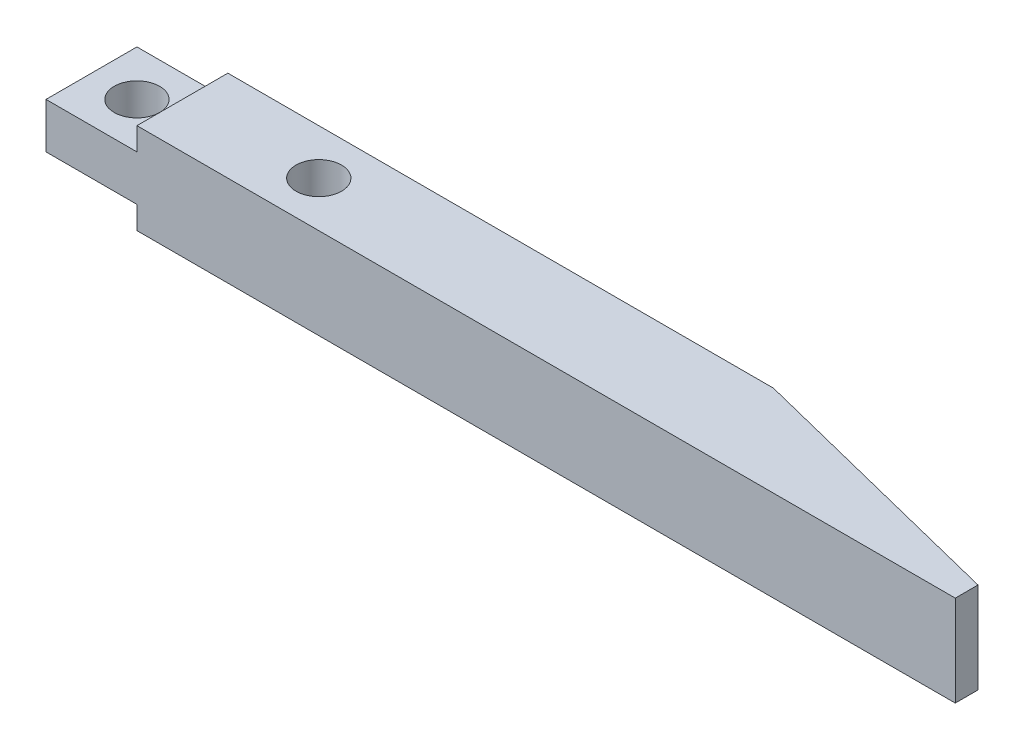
SolidWorks part; units mm, degrees
ref_plane "Front Plane" through (0, 0, 0) normal (0, 0, 1) x (1, 0, 0)
ref_plane "Top Plane" through (0, 0, 0) normal (0, 1, 0) x (1, 0, 0)
ref_plane "Right Plane" through (0, 0, 0) normal (1, 0, 0) x (0, 0, -1)
sketch "Sketch1" plane through (0, 0, 0) normal (0, 1, 0) x (1, 0, 0)
  line L0 (-1.0128, -6.35) -> (95.25, -6.35)
  line L1 (95.25, -6.35) -> (95.25, -3.175)
  line L2 (95.25, -3.175) -> (57.15, 6.35)
  line L3 (57.15, 6.35) -> (-31.75, 6.35)
  line L4 (-31.75, 6.35) -> (-31.75, -6.35)
  line L5 (-31.75, -6.35) -> (-1.0128, -6.35)
  circle A0 centre (0, 0) radius 3.175
  circle A1 centre (-25.4, 0) radius 3.175
  point P11 (-31.75, 0)
  dimension "D1" = 6.35
  dimension "D8" = 6.35
  dimension "D2" = 6.35
  dimension "D3" = 12.7
  dimension "D4" = 88.9
  dimension "D5" = 25.4
  dimension "D6" = 38.1
  dimension "D7" = 3.175
extrude "Boss-Extrude1" add sketch "Sketch1" along normal blind 12.7
sketch "Sketch3" plane through (0, 0, 6.35) normal (0, 0, 1) x (1, 0, 0)
  line L1 (-31.75, 12.7) -> (-19.05, 12.7)
  line L2 (-31.75, 12.7) -> (-31.75, 9.525)
  line L3 (-31.75, 9.525) -> (-19.05, 9.525)
  line L4 (-19.05, 12.7) -> (-19.05, 9.525)
  line L5 (-31.75, 0) -> (-19.05, 0)
  line L6 (-31.75, 0) -> (-31.75, 3.175)
  line L7 (-31.75, 3.175) -> (-19.05, 3.175)
  line L8 (-19.05, 0) -> (-19.05, 3.175)
  dimension "D1" = 3.175
  dimension "D2" = 3.175
  dimension "D3" = 12.7
  dimension "D4" = 12.7
extrude "Cut-Extrude2" cut sketch "Sketch3" against normal blind 12.7
